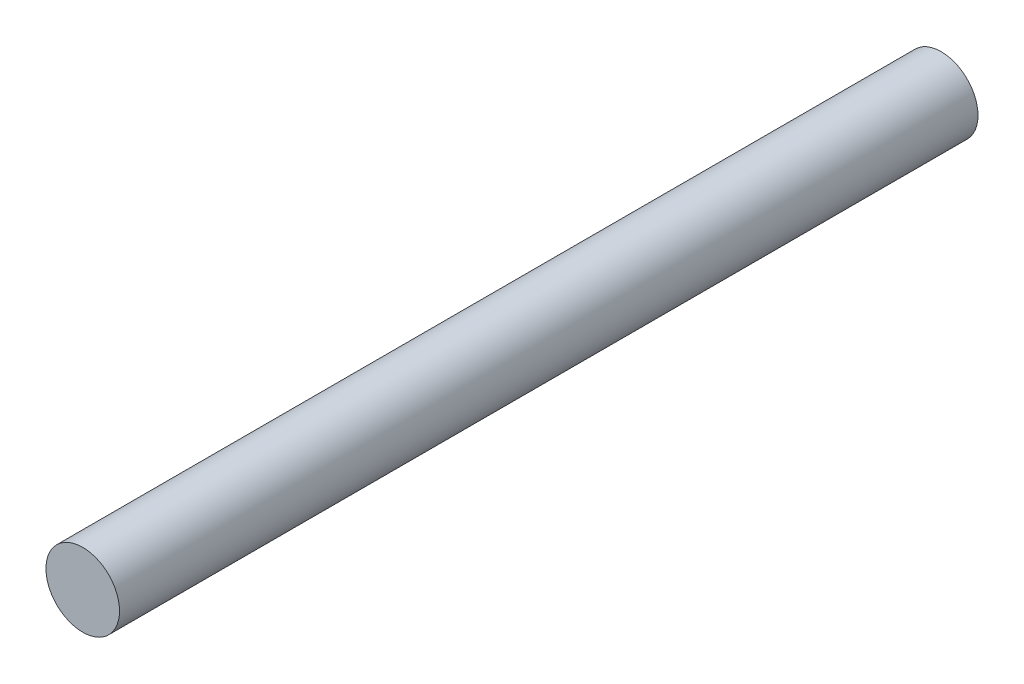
SolidWorks part; units mm, degrees
ref_plane "Front Plane" through (0, 0, 0) normal (0, 0, 1) x (1, 0, 0)
ref_plane "Top Plane" through (0, 0, 0) normal (0, 1, 0) x (1, 0, 0)
ref_plane "Right Plane" through (0, 0, 0) normal (1, 0, 0) x (0, 0, -1)
sketch "Sketch1" plane through (0, 0, 0) normal (0, 0, 1) x (1, 0, 0)
  circle A0 centre (0, 0) radius 30
  dimension "D1" = 60
extrude "Boss-Extrude1" add sketch "Sketch1" against normal blind 700
